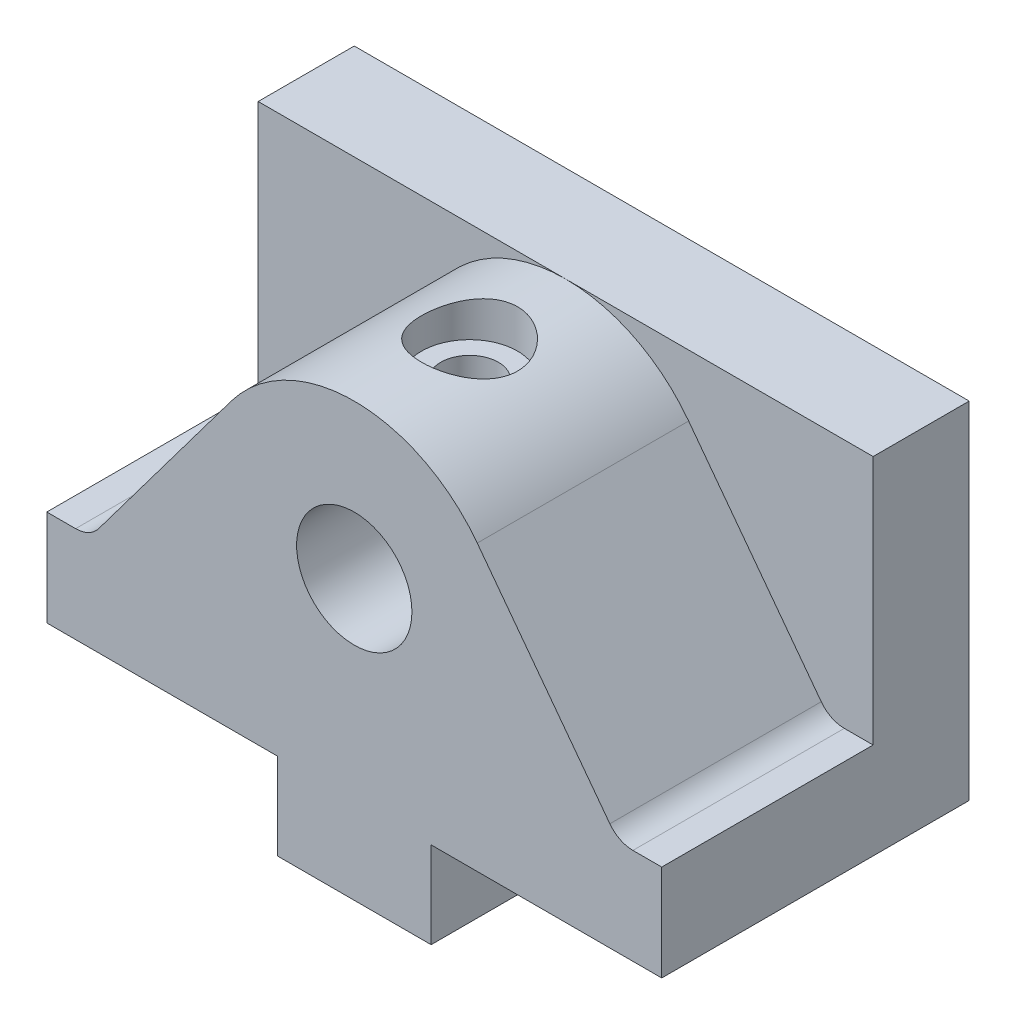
SolidWorks part; units mm, degrees
ref_plane "Front" through (0, 0, 0) normal (0, 0, 1) x (1, 0, 0)
ref_plane "Top" through (0, 0, 0) normal (0, 1, 0) x (1, 0, 0)
ref_plane "Right" through (0, 0, 0) normal (1, 0, 0) x (0, 0, -1)
sketch "Sketch1" plane through (0, 0, 0) normal (0, 0, 1) x (1, 0, 0)
  line L0 (0, 35.7198) -> (0, -31.9855) construction
  line L1 (-32, 22) -> (32, 22)
  line L2 (32, 22) -> (32, -14)
  line L3 (32, -14) -> (8, -14)
  line L4 (8, -14) -> (8, -23)
  line L5 (8, -23) -> (-8, -23)
  line L6 (-8, -14) -> (-8, -23)
  line L7 (-32, -14) -> (-8, -14)
  line L8 (-32, 22) -> (-32, -14)
  point P10 (0, -23)
  point P13 (0, 22)
  dimension "D1" = 64
  dimension "D2" = 36
  dimension "D3" = 9
  dimension "D4" = 16
  dimension "D5" = 23
extrude "Extrude1" add sketch "Sketch1" along normal blind 32
sketch "Sketch2" plane through (0, 0, 32) normal (0, 0, 1) x (1, 0, 0)
  line L0 (12.8, 15.6) -> (27.5, -4)
  line L1 (27.5, -4) -> (32, -4)
  line L2 (32, -14) -> (32, 22) construction
  line L3 (32, 22) -> (-32, 22) construction
  line L4 (0, 30.4947) -> (0, -33.3559) construction
  line L5 (-27.5, -4) -> (-32, -4)
  line L6 (-12.8, 15.6) -> (-27.5, -4)
  line L7 (8, -14) -> (32, -14) construction
  line L8 (-32, -4) -> (-34.9332, -4)
  line L9 (-34.9332, -4) -> (-34.9332, 29.2569)
  line L10 (-34.9332, 29.2569) -> (38.9733, 29.2569)
  line L11 (38.9733, 29.2569) -> (38.9733, -4)
  line L12 (38.9733, -4) -> (32, -4)
  arc A0 (-12.8, 15.6) -> (12.8, 15.6) centre (0, 6) cw
  dimension "D1" = 16
  dimension "D2" = 55
  dimension "D3" = 10
extrude "Cut-Extrude1" cut sketch "Sketch2" against normal blind 22
fillet "Fillet1" radius 3 2 edges at (-27.5, -4, 21) (27.5, -4, 21)
other "Hole1" parameters "D1"=61
sketch "Sketch3" plane through (0, 0, 32) normal (0, 0, 1) x (1, 0, 0)
  circle A0 centre (0, 6) radius 6
  arc A1 (12.8, 15.6) -> (-12.8, 15.6) centre (0, 6) ccw construction
  dimension "D1" = 12
hole_wizard "CBORE for M3 SBHCS1" positions "3DSketch2" profile "Sketch5" counterbore size "M3" standard "Ansi Metric"
sketch3d "3DSketch2"
  line L0 (32, 22, 0) -> (-32, 22, 0) construction
  line L2 (32, 22, 10) -> (32, 22, 0) construction
  point P0 (0, 22, 20)
  dimension "D1" = 20
  dimension "D2" = 32
sketch "Sketch5" plane through (0, 22, 20) normal (1, 0, 0) x (0, 0, 1)
  line L0 (0, 0) -> (0, 10)
  line L1 (0, 10) -> (3, 10)
  line L3 (3, 10) -> (3, 4)
  line L4 (3, 4) -> (5, 4)
  line L5 (5, 4) -> (5, 0)
  line L7 (5, 0) -> (0, 0)
  line L11 (0, -6.35) -> (0, 107.95) construction
  dimension "Thru Hole Dia." = 6
  dimension "Thru Hole Depth" = 10
  dimension "C'Bore Dia." = 10
  dimension "C'Bore Depth" = 4
ref_plane "Plane1" through (0, 0, 24) normal (0, 0, 1) x (1, 0, 0)
sketch "Sketch6" plane through (0, 0, 24) normal (0, 0, 1) x (1, 0, 0)
  line L0 (0, 32.955) -> (0, -32.955) construction
  line L1 (0, -23) -> (3, -23)
  line L2 (-8, -23) -> (8, -23) construction
  line L3 (3, -23) -> (3, -7)
  line L4 (3, -7) -> (0, -5.2679)
  line L5 (0, -5.2679) -> (0, -23)
  dimension "D1" = 16
  dimension "D2" = 6
  dimension "D3" = 60
revolve "Cut-Revolve1" cut sketch "Sketch6" angle 360 about L0
pattern_linear "LPattern1" count 2 spacing 16 along (0, 0, -1) of "Cut-Revolve1"
